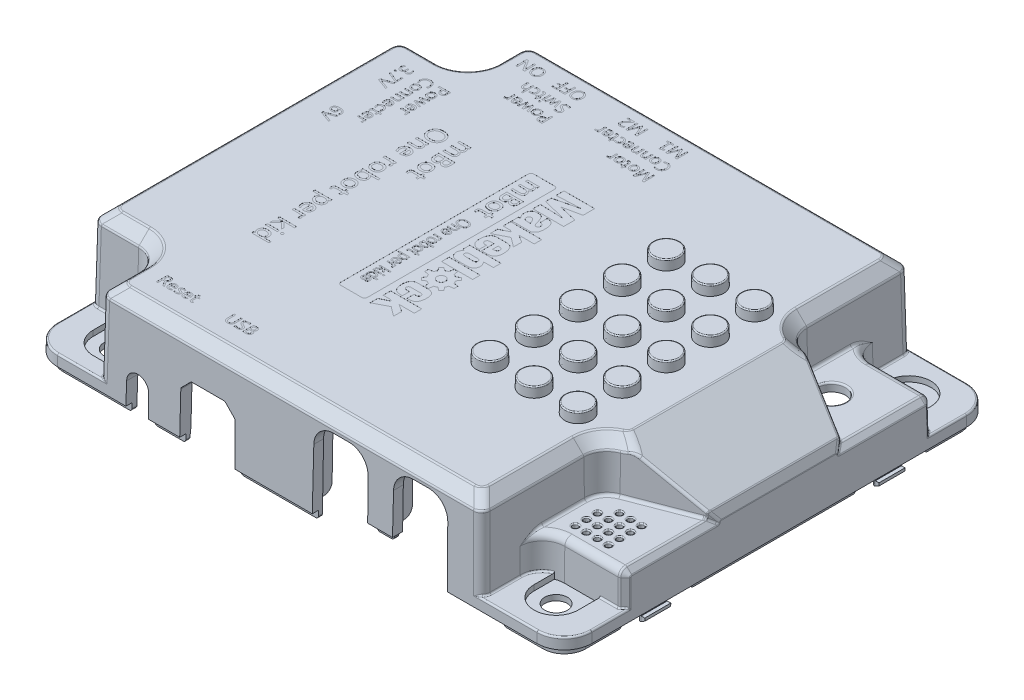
SolidWorks part; units mm, degrees
ref_plane "前视基准面" through (0, 0, 0) normal (0, 0, 1) x (1, 0, 0)
ref_plane "上视基准面" through (0, 0, 0) normal (0, 1, 0) x (1, 0, 0)
ref_plane "右视基准面" through (0, 0, 0) normal (1, 0, 0) x (0, 0, -1)
imported_body "曲面-输入2" [suppressed]
imported_body "曲面-输入3" [suppressed]
imported_body "曲面-输入4" [suppressed]
imported_body "曲面-输入5" [suppressed]
imported_body "曲面-输入6" [suppressed]
imported_body "曲面-输入7" [suppressed]
imported_body "曲面-输入8" [suppressed]
imported_body "曲面-输入9" [suppressed]
imported_body "输入1"
sketch "草图1" plane through (0, 27, 0) normal (0, 1, 0) x (1, 0, 0)
  line L0 (0, 0) -> (-42.1126, 0) construction
  line L1 (-32.3217, 25) -> (-44.3217, 25)
  line L2 (-32.3217, 36) -> (0.6783, 36)
  line L3 (-32.3217, 36) -> (-32.3217, -36) construction
  line L4 (-32.3217, -36) -> (0.6783, -36)
  line L5 (0.6783, 36) -> (0.6783, -36)
  line L6 (-32.3217, 36) -> (0.6783, -36) construction
  line L7 (-32.3217, -36) -> (0.6783, 36) construction
  line L8 (-44.3217, 25) -> (-44.3217, -25)
  line L9 (-32.3217, -25) -> (-44.3217, -25)
  line L12 (-48.2417, 26.2254) -> (-48.2417, -26.2254) construction
  line L13 (-32.3217, -25) -> (-32.3217, -36)
  line L14 (-32.3217, 36) -> (-32.3217, 25)
  point P3 (-15.8217, 0)
  point P12 (-44.3217, 0)
  dimension "D1" = 72
  dimension "D2" = 33
  dimension "D3" = 12
  dimension "D4" = 50
  dimension "D5" = 3.92
sketch "草图4" plane through (0, 27, 0) normal (0, 1, 0) x (1, 0, 0)
  line L0 (-8.1683, 17.5926) -> (-2.5917, 17.5926)
  line L1 (-2.5917, 17.5926) -> (-2.5917, 15.4914)
  line L2 (-2.5917, 15.4914) -> (-5.9326, 14.7724)
  line L3 (-5.9326, 14.7724) -> (-2.5917, 13.9973)
  line L4 (-2.5917, 13.9973) -> (-2.5917, 11.9615)
  line L5 (-2.5917, 11.9615) -> (-8.1683, 11.9615)
  line L6 (-8.1683, 11.9615) -> (-8.1683, 13.3249)
  line L7 (-8.1683, 13.3249) -> (-3.8728, 13.1942)
  line L8 (-3.8728, 13.1942) -> (-8.1683, 14.2587)
  line L9 (-8.1683, 14.2587) -> (-8.1683, 15.2953)
  line L10 (-8.1683, 15.2953) -> (-3.8728, 16.3599)
  line L11 (-3.8728, 16.3599) -> (-8.1683, 16.1638)
  line L12 (-8.1683, 16.1638) -> (-8.1683, 17.5926)
  line L13 (-5.3465, 10.4516) -> (-5.3465, 11.7496)
  line L14 (-5.0032, 8.1543) -> (-7.4147, 8.1543)
  line L15 (-8.1683, 8.0236) -> (-8.1683, 9.3216)
  line L16 (-8.1683, 9.3216) -> (-7.758, 9.387)
  line L17 (-6.77, 9.4524) -> (-6.1085, 9.4524)
  line L18 (-8.1683, 7.9118) -> (-2.5164, 7.9118)
  line L19 (-2.5164, 7.9118) -> (-2.5164, 6.5484)
  line L20 (-2.5164, 6.5484) -> (-5.2879, 6.5484)
  line L21 (-5.2879, 6.5484) -> (-3.9315, 5.6799)
  line L22 (-3.9315, 5.6799) -> (-3.9315, 4.1857)
  line L23 (-3.9315, 4.1857) -> (-5.6396, 5.4838)
  line L24 (-5.6396, 5.4838) -> (-8.1683, 4.1857)
  line L25 (-8.1683, 4.1857) -> (-8.1683, 5.5492)
  line L26 (-8.1683, 5.5492) -> (-6.5355, 6.3522)
  line L27 (-6.5355, 6.3522) -> (-6.8286, 6.5484)
  line L28 (-6.8286, 6.5484) -> (-8.1683, 6.5484)
  line L29 (-8.1683, 6.5484) -> (-8.1683, 7.9118)
  line L30 (-6.2257, 2.9396) -> (-6.8872, 2.9396)
  line L31 (-6.8286, 2.0058) -> (-6.6527, 2.0058)
  line L32 (-6.6527, 2.0058) -> (-6.6527, 0.7077)
  line L33 (-6.6527, 0.7077) -> (-6.8118, 0.7077)
  line L34 (-6.9458, 4.2377) -> (-5.1707, 4.2377)
  line L35 (-5.1204, 0.7077) -> (-6.2257, 0.7077)
  line L36 (-6.2257, 0.7077) -> (-6.2257, 2.9396)
  line L37 (-5.4637, 2.9396) -> (-5.4637, 1.9404)
  line L38 (-5.4637, 1.9404) -> (-5.3047, 1.9404)
  line L39 (-8.1683, 0.5043) -> (-2.5164, 0.5043)
  line L40 (-2.5164, 0.5043) -> (-2.5164, -0.8591)
  line L41 (-2.5164, -0.8591) -> (-4.2831, -0.8591)
  line L42 (-5.1707, -3.0256) -> (-7.1216, -3.0256)
  line L43 (-7.8166, -0.7937) -> (-8.1683, -0.7937)
  line L44 (-8.1683, -0.7937) -> (-8.1683, 0.5043)
  line L45 (-5.3465, -0.8591) -> (-6.8286, -0.8591)
  line L46 (-6.8286, -1.6622) -> (-5.3465, -1.6622)
  line L47 (-8.1683, -3.2474) -> (-2.5164, -3.2474)
  line L48 (-2.5164, -3.2474) -> (-2.5164, -4.6202)
  line L49 (-2.5164, -4.6202) -> (-8.1683, -4.6202)
  line L50 (-8.1683, -4.6202) -> (-8.1683, -3.2474)
  line L51 (-6.3463, -12.2571) -> (-6.3463, -13.5552)
  line L52 (-6.3463, -13.5552) -> (-6.5388, -13.5552)
  line L53 (-6.8738, -10.156) -> (-5.0987, -10.156)
  line L54 (-5.3498, -13.5552) -> (-5.5089, -13.5552)
  line L55 (-5.5089, -13.5552) -> (-5.5089, -12.2571)
  line L56 (-5.5089, -12.2571) -> (-5.0987, -12.2571)
  line L57 (-5.0484, -11.454) -> (-6.8738, -11.454)
  line L58 (-6.8738, -12.2571) -> (-6.3463, -12.2571)
  line L59 (-8.1683, -13.8491) -> (-2.5164, -13.8491)
  line L60 (-2.5164, -13.8491) -> (-2.5164, -15.2125)
  line L61 (-2.5164, -15.2125) -> (-5.2879, -15.2125)
  line L62 (-5.2879, -15.2125) -> (-3.9315, -16.0809)
  line L63 (-3.9315, -16.0809) -> (-3.9315, -17.5751)
  line L64 (-3.9315, -17.5751) -> (-5.6396, -16.2771)
  line L65 (-5.6396, -16.2771) -> (-8.1683, -17.5751)
  line L66 (-8.1683, -17.5751) -> (-8.1683, -16.2117)
  line L67 (-8.1683, -16.2117) -> (-6.5355, -15.4086)
  line L68 (-6.5355, -15.4086) -> (-6.8286, -15.2125)
  line L69 (-6.8286, -15.2125) -> (-8.1683, -15.2125)
  line L70 (-8.1683, -15.2125) -> (-8.1683, -13.8491)
  line L71 (-3.8532, -8.3635) -> (-3.4224, -8.9566)
  line L72 (-4.994, -9.2045) -> (-5.1271, -10.0437)
  line L73 (-6.4551, -8.9829) -> (-7.0481, -9.4136)
  line L74 (-7.5052, -8.9565) -> (-7.0745, -8.3633)
  line L75 (-7.2959, -7.842) -> (-8.1352, -7.7089)
  line L76 (-7.0742, -6.3811) -> (-7.5051, -5.7878)
  line L77 (-5.9336, -5.5402) -> (-5.8004, -4.7007)
  line L78 (-4.4726, -5.7618) -> (-3.8794, -5.3309)
  line L79 (-3.4223, -5.7879) -> (-3.8531, -6.3813)
  line L80 (-3.6316, -6.9024) -> (-2.7922, -7.0355)
  line L83 (-2.5917, 36) -> (-2.5917, -36) construction
  line L84 (-32.3217, 36) -> (0.6783, 36) construction
  line L85 (-32.3217, -36) -> (0.6783, -36) construction
  line L86 (0.6783, 36) -> (0.6783, -36) construction
  spline S0 degree 3 poles (-7.758, 9.387) (-7.9031, 9.4617) (-8.0176, 9.5846) (-8.1013, 9.7558) knots 0 0 0 0 0.027027 0.027027 0.027027 0.027027
  spline S1 degree 3 poles (-8.1013, 9.7558) (-8.185, 9.9271) (-8.2408, 10.1092) (-8.2688, 10.3022) knots 0.027027 0.027027 0.027027 0.027027 0.054054 0.054054 0.054054 0.054054
  spline S2 degree 3 poles (-8.2688, 10.3022) (-8.2688, 10.3333) (-8.2702, 10.366) (-8.273, 10.4002) knots 0.054054 0.054054 0.054054 0.054054 0.081081 0.081081 0.081081 0.081081
  spline S3 degree 3 poles (-8.273, 10.4002) (-8.2757, 10.4345) (-8.2771, 10.4672) (-8.2771, 10.4983) knots 0.081081 0.081081 0.081081 0.081081 0.108108 0.108108 0.108108 0.108108
  spline S4 degree 3 poles (-8.2771, 10.4983) (-8.2771, 10.5045) (-8.2771, 10.5123) (-8.2771, 10.5216) knots 0.108108 0.108108 0.108108 0.108108 0.135135 0.135135 0.135135 0.135135
  spline S5 degree 3 poles (-8.2771, 10.5216) (-8.2771, 10.5309) (-8.2771, 10.5418) (-8.2771, 10.5543) knots 0.135135 0.135135 0.135135 0.135135 0.162162 0.162162 0.162162 0.162162
  spline S6 degree 3 poles (-8.2771, 10.5543) (-8.266, 10.8531) (-8.1683, 11.1271) (-7.9841, 11.3761) knots 0.162162 0.162162 0.162162 0.162162 0.189189 0.189189 0.189189 0.189189
  spline S7 degree 3 poles (-7.9841, 11.3761) (-7.7998, 11.6251) (-7.5124, 11.7496) (-7.1216, 11.7496) knots 0.189189 0.189189 0.189189 0.189189 0.216216 0.216216 0.216216 0.216216
  spline S8 degree 3 poles (-7.1216, 11.7496) (-6.6471, 11.7496) (-6.329, 11.6593) (-6.1671, 11.4788) knots 0.216216 0.216216 0.216216 0.216216 0.243243 0.243243 0.243243 0.243243
  spline S9 degree 3 poles (-6.1671, 11.4788) (-6.0052, 11.2983) (-5.8768, 11.0399) (-5.7819, 10.7037) knots 0.243243 0.243243 0.243243 0.243243 0.27027 0.27027 0.27027 0.27027
  spline S10 degree 3 poles (-5.7819, 10.7037) (-5.7429, 10.5792) (-5.7038, 10.4453) (-5.6647, 10.3022) knots 0.27027 0.27027 0.27027 0.27027 0.297297 0.297297 0.297297 0.297297
  spline S11 degree 3 poles (-5.6647, 10.3022) (-5.6256, 10.159) (-5.5782, 10.0064) (-5.5224, 9.8446) knots 0.297297 0.297297 0.297297 0.297297 0.324324 0.324324 0.324324 0.324324
  spline S12 degree 3 poles (-5.5224, 9.8446) (-5.4889, 9.745) (-5.447, 9.6672) (-5.3968, 9.6111) knots 0.324324 0.324324 0.324324 0.324324 0.351351 0.351351 0.351351 0.351351
  spline S13 degree 3 poles (-5.3968, 9.6111) (-5.3465, 9.5551) (-5.2935, 9.5146) (-5.2377, 9.4897) knots 0.351351 0.351351 0.351351 0.351351 0.378378 0.378378 0.378378 0.378378
  spline S14 degree 3 poles (-5.2377, 9.4897) (-5.2153, 9.4773) (-5.193, 9.4679) (-5.1707, 9.4617) knots 0.378378 0.378378 0.378378 0.378378 0.405405 0.405405 0.405405 0.405405
  spline S15 degree 3 poles (-5.1707, 9.4617) (-5.1484, 9.4555) (-5.126, 9.4524) (-5.1037, 9.4524) knots 0.405405 0.405405 0.405405 0.405405 0.432432 0.432432 0.432432 0.432432
  spline S16 degree 3 poles (-5.1037, 9.4524) (-5.0981, 9.4524) (-5.0939, 9.4524) (-5.0911, 9.4524) knots 0.432432 0.432432 0.432432 0.432432 0.459459 0.459459 0.459459 0.459459
  spline S17 degree 3 poles (-5.0911, 9.4524) (-5.0883, 9.4524) (-5.0842, 9.4524) (-5.0786, 9.4524) knots 0.459459 0.459459 0.459459 0.459459 0.486486 0.486486 0.486486 0.486486
  spline S18 degree 3 poles (-5.0786, 9.4524) (-4.9893, 9.4586) (-4.9055, 9.499) (-4.8274, 9.5738) knots 0.486486 0.486486 0.486486 0.486486 0.513514 0.513514 0.513514 0.513514
  spline S19 degree 3 poles (-4.8274, 9.5738) (-4.7492, 9.6485) (-4.7102, 9.7388) (-4.7102, 9.8446) knots 0.513514 0.513514 0.513514 0.513514 0.540541 0.540541 0.540541 0.540541
  spline S20 degree 3 poles (-4.7102, 9.8446) (-4.7102, 10.0811) (-4.759, 10.2415) (-4.8567, 10.3255) knots 0.540541 0.540541 0.540541 0.540541 0.567568 0.567568 0.567568 0.567568
  spline S21 degree 3 poles (-4.8567, 10.3255) (-4.9544, 10.4095) (-5.1176, 10.4516) (-5.3465, 10.4516) knots 0.567568 0.567568 0.567568 0.567568 0.594595 0.594595 0.594595 0.594595
  spline S22 degree 3 poles (-5.3465, 11.7496) (-4.8162, 11.7496) (-4.438, 11.594) (-4.2119, 11.2827) knots 0.621622 0.621622 0.621622 0.621622 0.648649 0.648649 0.648649 0.648649
  spline S23 degree 3 poles (-4.2119, 11.2827) (-3.9859, 10.9714) (-3.8728, 10.5418) (-3.8728, 9.994) knots 0.648649 0.648649 0.648649 0.648649 0.675676 0.675676 0.675676 0.675676
  spline S24 degree 3 poles (-3.8728, 9.994) (-3.8728, 9.3216) (-3.9719, 8.8578) (-4.1701, 8.6026) knots 0.675676 0.675676 0.675676 0.675676 0.702703 0.702703 0.702703 0.702703
  spline S25 degree 3 poles (-4.1701, 8.6026) (-4.3682, 8.3473) (-4.5873, 8.201) (-4.8274, 8.1636) knots 0.702703 0.702703 0.702703 0.702703 0.72973 0.72973 0.72973 0.72973
  spline S26 degree 3 poles (-4.8274, 8.1636) (-4.8553, 8.1636) (-4.8846, 8.1621) (-4.9153, 8.159) knots 0.72973 0.72973 0.72973 0.72973 0.756757 0.756757 0.756757 0.756757
  spline S27 degree 3 poles (-4.9153, 8.159) (-4.946, 8.1559) (-4.9753, 8.1543) (-5.0032, 8.1543) knots 0.756757 0.756757 0.756757 0.756757 0.783784 0.783784 0.783784 0.783784
  spline S28 degree 3 poles (-7.4147, 8.1543) (-7.5766, 8.1543) (-7.691, 8.1481) (-7.758, 8.1357) knots 0.810811 0.810811 0.810811 0.810811 0.837838 0.837838 0.837838 0.837838
  spline S29 degree 3 poles (-7.758, 8.1357) (-7.825, 8.1232) (-7.8836, 8.1108) (-7.9338, 8.0983) knots 0.837838 0.837838 0.837838 0.837838 0.864865 0.864865 0.864865 0.864865
  spline S30 degree 3 poles (-7.9338, 8.0983) (-7.9673, 8.0858) (-8.0008, 8.0734) (-8.0343, 8.0609) knots 0.864865 0.864865 0.864865 0.864865 0.891892 0.891892 0.891892 0.891892
  spline S31 degree 3 poles (-8.0343, 8.0609) (-8.0678, 8.0485) (-8.1125, 8.036) (-8.1683, 8.0236) knots 0.891892 0.891892 0.891892 0.891892 0.918919 0.918919 0.918919 0.918919
  spline S32 degree 3 poles (-6.1085, 9.4524) (-6.1364, 9.5146) (-6.1629, 9.5753) (-6.188, 9.6345) knots 0 0 0 0 0.055556 0.055556 0.055556 0.055556
  spline S33 degree 3 poles (-6.188, 9.6345) (-6.2131, 9.6936) (-6.2396, 9.7512) (-6.2676, 9.8072) knots 0.055556 0.055556 0.055556 0.055556 0.111111 0.111111 0.111111 0.111111
  spline S34 degree 3 poles (-6.2676, 9.8072) (-6.3457, 9.9878) (-6.4322, 10.1419) (-6.5271, 10.2695) knots 0.111111 0.111111 0.111111 0.111111 0.166667 0.166667 0.166667 0.166667
  spline S35 degree 3 poles (-6.5271, 10.2695) (-6.622, 10.3971) (-6.756, 10.4609) (-6.929, 10.4609) knots 0.166667 0.166667 0.166667 0.166667 0.222222 0.222222 0.222222 0.222222
  spline S36 degree 3 poles (-6.929, 10.4609) (-6.9346, 10.4609) (-6.9402, 10.4609) (-6.9458, 10.4609) knots 0.222222 0.222222 0.222222 0.222222 0.277778 0.277778 0.277778 0.277778
  spline S37 degree 3 poles (-6.9458, 10.4609) (-6.9514, 10.4609) (-6.957, 10.4578) (-6.9625, 10.4516) knots 0.277778 0.277778 0.277778 0.277778 0.333333 0.333333 0.333333 0.333333
  spline S38 degree 3 poles (-6.9625, 10.4516) (-6.9681, 10.4516) (-6.9737, 10.4516) (-6.9793, 10.4516) knots 0.333333 0.333333 0.333333 0.333333 0.388889 0.388889 0.388889 0.388889
  spline S39 degree 3 poles (-6.9793, 10.4516) (-6.9849, 10.4516) (-6.9932, 10.4516) (-7.0044, 10.4516) knots 0.388889 0.388889 0.388889 0.388889 0.444444 0.444444 0.444444 0.444444
  spline S40 degree 3 poles (-7.0044, 10.4516) (-7.1105, 10.4453) (-7.1984, 10.4002) (-7.2682, 10.3161) knots 0.444444 0.444444 0.444444 0.444444 0.5 0.5 0.5 0.5
  spline S41 degree 3 poles (-7.2682, 10.3161) (-7.3379, 10.2321) (-7.3784, 10.1434) (-7.3896, 10.05) knots 0.5 0.5 0.5 0.5 0.555556 0.555556 0.555556 0.555556
  spline S42 degree 3 poles (-7.3896, 10.05) (-7.3952, 10.0376) (-7.398, 10.0251) (-7.398, 10.0127) knots 0.555556 0.555556 0.555556 0.555556 0.611111 0.611111 0.611111 0.611111
  spline S43 degree 3 poles (-7.398, 10.0127) (-7.398, 10.0002) (-7.398, 9.9878) (-7.398, 9.9753) knots 0.611111 0.611111 0.611111 0.611111 0.666667 0.666667 0.666667 0.666667
  spline S44 degree 3 poles (-7.398, 9.9753) (-7.398, 9.9629) (-7.3966, 9.9489) (-7.3938, 9.9333) knots 0.666667 0.666667 0.666667 0.666667 0.722222 0.722222 0.722222 0.722222
  spline S45 degree 3 poles (-7.3938, 9.9333) (-7.391, 9.9177) (-7.3896, 9.9037) (-7.3896, 9.8913) knots 0.722222 0.722222 0.722222 0.722222 0.777778 0.777778 0.777778 0.777778
  spline S46 degree 3 poles (-7.3896, 9.8913) (-7.3672, 9.7792) (-7.3045, 9.678) (-7.2012, 9.5878) knots 0.777778 0.777778 0.777778 0.777778 0.833333 0.833333 0.833333 0.833333
  spline S47 degree 3 poles (-7.2012, 9.5878) (-7.0979, 9.4975) (-6.9542, 9.4524) (-6.77, 9.4524) knots 0.833333 0.833333 0.833333 0.833333 0.888889 0.888889 0.888889 0.888889
  spline S48 degree 3 poles (-6.8872, 2.9396) (-7.0546, 2.9396) (-7.1872, 2.8945) (-7.2849, 2.8042) knots 0.041667 0.041667 0.041667 0.041667 0.083333 0.083333 0.083333 0.083333
  spline S49 degree 3 poles (-7.2849, 2.8042) (-7.3826, 2.714) (-7.4342, 2.6159) (-7.4398, 2.51) knots 0.083333 0.083333 0.083333 0.083333 0.125 0.125 0.125 0.125
  spline S50 degree 3 poles (-7.4398, 2.51) (-7.4398, 2.5038) (-7.4398, 2.4992) (-7.4398, 2.496) knots 0.125 0.125 0.125 0.125 0.166667 0.166667 0.166667 0.166667
  spline S51 degree 3 poles (-7.4398, 2.496) (-7.4398, 2.4929) (-7.4398, 2.4883) (-7.4398, 2.4821) knots 0.166667 0.166667 0.166667 0.166667 0.208333 0.208333 0.208333 0.208333
  spline S52 degree 3 poles (-7.4398, 2.4821) (-7.4398, 2.4758) (-7.4398, 2.4711) (-7.4398, 2.468) knots 0.208333 0.208333 0.208333 0.208333 0.25 0.25 0.25 0.25
  spline S53 degree 3 poles (-7.4398, 2.468) (-7.4398, 2.4649) (-7.4398, 2.4603) (-7.4398, 2.454) knots 0.25 0.25 0.25 0.25 0.291667 0.291667 0.291667 0.291667
  spline S54 degree 3 poles (-7.4398, 2.454) (-7.4342, 2.342) (-7.3798, 2.2393) (-7.2765, 2.1459) knots 0.291667 0.291667 0.291667 0.291667 0.333333 0.333333 0.333333 0.333333
  spline S55 degree 3 poles (-7.2765, 2.1459) (-7.1733, 2.0525) (-7.0239, 2.0058) (-6.8286, 2.0058) knots 0.333333 0.333333 0.333333 0.333333 0.375 0.375 0.375 0.375
  spline S56 degree 3 poles (-6.8118, 0.7077) (-7.264, 0.7077) (-7.6212, 0.8478) (-7.8836, 1.128) knots 0.5 0.5 0.5 0.5 0.541667 0.541667 0.541667 0.541667
  spline S57 degree 3 poles (-7.8836, 1.128) (-8.1459, 1.4081) (-8.2771, 1.8097) (-8.2771, 2.3326) knots 0.541667 0.541667 0.541667 0.541667 0.583333 0.583333 0.583333 0.583333
  spline S58 degree 3 poles (-8.2771, 2.3326) (-8.2771, 2.8992) (-8.1641, 3.3583) (-7.938, 3.71) knots 0.583333 0.583333 0.583333 0.583333 0.625 0.625 0.625 0.625
  spline S59 degree 3 poles (-7.938, 3.71) (-7.7119, 4.0618) (-7.3812, 4.2377) (-6.9458, 4.2377) knots 0.625 0.625 0.625 0.625 0.666667 0.666667 0.666667 0.666667
  spline S60 degree 3 poles (-5.1707, 4.2377) (-4.6683, 4.2377) (-4.3166, 4.0447) (-4.1156, 3.6587) knots 0.708333 0.708333 0.708333 0.708333 0.75 0.75 0.75 0.75
  spline S61 degree 3 poles (-4.1156, 3.6587) (-3.9147, 3.2727) (-3.8142, 2.8307) (-3.8142, 2.3326) knots 0.75 0.75 0.75 0.75 0.791667 0.791667 0.791667 0.791667
  spline S62 degree 3 poles (-3.8142, 2.3326) (-3.8142, 1.8097) (-3.9273, 1.4081) (-4.1533, 1.128) knots 0.791667 0.791667 0.791667 0.791667 0.833333 0.833333 0.833333 0.833333
  spline S63 degree 3 poles (-4.1533, 1.128) (-4.3794, 0.8478) (-4.7018, 0.7077) (-5.1204, 0.7077) knots 0.833333 0.833333 0.833333 0.833333 0.875 0.875 0.875 0.875
  spline S64 degree 3 poles (-5.3047, 1.9404) (-5.126, 1.9404) (-4.9725, 1.9871) (-4.8441, 2.0805) knots 0.222222 0.222222 0.222222 0.222222 0.333333 0.333333 0.333333 0.333333
  spline S65 degree 3 poles (-4.8441, 2.0805) (-4.7157, 2.1739) (-4.6515, 2.3077) (-4.6515, 2.4821) knots 0.333333 0.333333 0.333333 0.333333 0.444444 0.444444 0.444444 0.444444
  spline S66 degree 3 poles (-4.6515, 2.4821) (-4.6515, 2.675) (-4.7339, 2.7996) (-4.8985, 2.8556) knots 0.444444 0.444444 0.444444 0.444444 0.555556 0.555556 0.555556 0.555556
  spline S67 degree 3 poles (-4.8985, 2.8556) (-5.0632, 2.9116) (-5.2432, 2.9396) (-5.4386, 2.9396) knots 0.555556 0.555556 0.555556 0.555556 0.666667 0.666667 0.666667 0.666667
  spline S68 degree 3 poles (-5.4386, 2.9396) (-5.4442, 2.9396) (-5.4484, 2.9396) (-5.4512, 2.9396) knots 0.666667 0.666667 0.666667 0.666667 0.777778 0.777778 0.777778 0.777778
  spline S69 degree 3 poles (-5.4512, 2.9396) (-5.454, 2.9396) (-5.4581, 2.9396) (-5.4637, 2.9396) knots 0.777778 0.777778 0.777778 0.777778 1 1 1 1
  spline S70 degree 3 poles (-4.2831, -0.8591) (-4.2329, -0.9214) (-4.1868, -0.9868) (-4.145, -1.0552) knots 0.157895 0.157895 0.157895 0.157895 0.210526 0.210526 0.210526 0.210526
  spline S71 degree 3 poles (-4.145, -1.0552) (-4.1031, -1.1237) (-4.0654, -1.1891) (-4.0319, -1.2513) knots 0.210526 0.210526 0.210526 0.210526 0.263158 0.263158 0.263158 0.263158
  spline S72 degree 3 poles (-4.0319, -1.2513) (-3.9761, -1.3634) (-3.9356, -1.4755) (-3.9105, -1.5875) knots 0.263158 0.263158 0.263158 0.263158 0.315789 0.315789 0.315789 0.315789
  spline S73 degree 3 poles (-3.9105, -1.5875) (-3.8854, -1.6996) (-3.8728, -1.8054) (-3.8728, -1.905) knots 0.315789 0.315789 0.315789 0.315789 0.368421 0.368421 0.368421 0.368421
  spline S74 degree 3 poles (-3.8728, -1.905) (-3.8728, -2.2163) (-3.9859, -2.4809) (-4.2119, -2.6988) knots 0.368421 0.368421 0.368421 0.368421 0.421053 0.421053 0.421053 0.421053
  spline S75 degree 3 poles (-4.2119, -2.6988) (-4.438, -2.9167) (-4.7576, -3.0256) (-5.1707, -3.0256) knots 0.421053 0.421053 0.421053 0.421053 0.473684 0.473684 0.473684 0.473684
  spline S76 degree 3 poles (-7.1216, -3.0256) (-7.4398, -3.0256) (-7.7175, -2.9043) (-7.9548, -2.6614) knots 0.526316 0.526316 0.526316 0.526316 0.578947 0.578947 0.578947 0.578947
  spline S77 degree 3 poles (-7.9548, -2.6614) (-8.192, -2.4186) (-8.3106, -2.1323) (-8.3106, -1.8023) knots 0.578947 0.578947 0.578947 0.578947 0.631579 0.631579 0.631579 0.631579
  spline S78 degree 3 poles (-8.3106, -1.8023) (-8.3106, -1.7276) (-8.3022, -1.6498) (-8.2855, -1.5689) knots 0.631579 0.631579 0.631579 0.631579 0.684211 0.684211 0.684211 0.684211
  spline S79 degree 3 poles (-8.2855, -1.5689) (-8.2688, -1.4879) (-8.2436, -1.407) (-8.2101, -1.326) knots 0.684211 0.684211 0.684211 0.684211 0.736842 0.736842 0.736842 0.736842
  spline S80 degree 3 poles (-8.2101, -1.326) (-8.1711, -1.2327) (-8.1194, -1.1408) (-8.0552, -1.0506) knots 0.736842 0.736842 0.736842 0.736842 0.789474 0.789474 0.789474 0.789474
  spline S81 degree 3 poles (-8.0552, -1.0506) (-7.9911, -0.9603) (-7.9115, -0.8747) (-7.8166, -0.7937) knots 0.789474 0.789474 0.789474 0.789474 0.842105 0.842105 0.842105 0.842105
  spline S82 degree 3 poles (-6.8286, -0.8591) (-6.9681, -0.8591) (-7.084, -0.8949) (-7.1761, -0.9665) knots 0.052632 0.052632 0.052632 0.052632 0.105263 0.105263 0.105263 0.105263
  spline S83 degree 3 poles (-7.1761, -0.9665) (-7.2682, -1.0381) (-7.3282, -1.1175) (-7.3561, -1.2046) knots 0.105263 0.105263 0.105263 0.105263 0.157895 0.157895 0.157895 0.157895
  spline S84 degree 3 poles (-7.3561, -1.2046) (-7.3561, -1.2171) (-7.3575, -1.2311) (-7.3603, -1.2467) knots 0.157895 0.157895 0.157895 0.157895 0.210526 0.210526 0.210526 0.210526
  spline S85 degree 3 poles (-7.3603, -1.2467) (-7.363, -1.2622) (-7.3644, -1.2762) (-7.3644, -1.2887) knots 0.210526 0.210526 0.210526 0.210526 0.263158 0.263158 0.263158 0.263158
  spline S86 degree 3 poles (-7.3644, -1.2887) (-7.3644, -1.2949) (-7.3644, -1.3027) (-7.3644, -1.312) knots 0.263158 0.263158 0.263158 0.263158 0.315789 0.315789 0.315789 0.315789
  spline S87 degree 3 poles (-7.3644, -1.312) (-7.3644, -1.3214) (-7.3644, -1.3291) (-7.3644, -1.3354) knots 0.315789 0.315789 0.315789 0.315789 0.368421 0.368421 0.368421 0.368421
  spline S88 degree 3 poles (-7.3644, -1.3354) (-7.3477, -1.4163) (-7.2947, -1.491) (-7.2054, -1.5595) knots 0.368421 0.368421 0.368421 0.368421 0.421053 0.421053 0.421053 0.421053
  spline S89 degree 3 poles (-7.2054, -1.5595) (-7.116, -1.628) (-6.9904, -1.6622) (-6.8286, -1.6622) knots 0.421053 0.421053 0.421053 0.421053 0.473684 0.473684 0.473684 0.473684
  spline S90 degree 3 poles (-5.3465, -1.6622) (-5.2181, -1.6622) (-5.1176, -1.6295) (-5.0451, -1.5642) knots 0.526316 0.526316 0.526316 0.526316 0.578947 0.578947 0.578947 0.578947
  spline S91 degree 3 poles (-5.0451, -1.5642) (-4.9725, -1.4988) (-4.9251, -1.4288) (-4.9027, -1.3541) knots 0.578947 0.578947 0.578947 0.578947 0.631579 0.631579 0.631579 0.631579
  spline S92 degree 3 poles (-4.9027, -1.3541) (-4.9027, -1.3354) (-4.9013, -1.3198) (-4.8985, -1.3074) knots 0.631579 0.631579 0.631579 0.631579 0.684211 0.684211 0.684211 0.684211
  spline S93 degree 3 poles (-4.8985, -1.3074) (-4.8958, -1.2949) (-4.8943, -1.2825) (-4.8943, -1.27) knots 0.684211 0.684211 0.684211 0.684211 0.736842 0.736842 0.736842 0.736842
  spline S94 degree 3 poles (-4.8943, -1.27) (-4.8943, -1.2638) (-4.8943, -1.256) (-4.8943, -1.2467) knots 0.736842 0.736842 0.736842 0.736842 0.789474 0.789474 0.789474 0.789474
  spline S95 degree 3 poles (-4.8943, -1.2467) (-4.8943, -1.2373) (-4.8943, -1.2295) (-4.8943, -1.2233) knots 0.789474 0.789474 0.789474 0.789474 0.842105 0.842105 0.842105 0.842105
  spline S96 degree 3 poles (-4.8943, -1.2233) (-4.9111, -1.1299) (-4.9586, -1.0459) (-5.0367, -0.9712) knots 0.842105 0.842105 0.842105 0.842105 0.894737 0.894737 0.894737 0.894737
  spline S97 degree 3 poles (-5.0367, -0.9712) (-5.1148, -0.8965) (-5.2181, -0.8591) (-5.3465, -0.8591) knots 0.894737 0.894737 0.894737 0.894737 1 1 1 1
  spline S98 degree 3 poles (-6.5388, -13.5552) (-7.164, -13.5552) (-7.598, -13.4011) (-7.8409, -13.0929) knots 0.060606 0.060606 0.060606 0.060606 0.090909 0.090909 0.090909 0.090909
  spline S99 degree 3 poles (-7.8409, -13.0929) (-8.0837, -12.7847) (-8.2051, -12.3474) (-8.2051, -11.7808) knots 0.090909 0.090909 0.090909 0.090909 0.121212 0.121212 0.121212 0.121212
  spline S100 degree 3 poles (-8.2051, -11.7808) (-8.2051, -11.289) (-8.099, -10.8952) (-7.8869, -10.5995) knots 0.121212 0.121212 0.121212 0.121212 0.151515 0.151515 0.151515 0.151515
  spline S101 degree 3 poles (-7.8869, -10.5995) (-7.6748, -10.3038) (-7.3371, -10.156) (-6.8738, -10.156) knots 0.151515 0.151515 0.151515 0.151515 0.181818 0.181818 0.181818 0.181818
  spline S102 degree 3 poles (-5.0987, -10.156) (-4.7135, -10.156) (-4.3911, -10.2618) (-4.1315, -10.4735) knots 0.212121 0.212121 0.212121 0.212121 0.242424 0.242424 0.242424 0.242424
  spline S103 degree 3 poles (-4.1315, -10.4735) (-3.872, -10.6851) (-3.7422, -11.0992) (-3.7422, -11.7155) knots 0.242424 0.242424 0.242424 0.242424 0.272727 0.272727 0.272727 0.272727
  spline S104 degree 3 poles (-3.7422, -11.7155) (-3.7422, -12.282) (-3.851, -12.7302) (-4.0687, -13.0602) knots 0.272727 0.272727 0.272727 0.272727 0.30303 0.30303 0.30303 0.30303
  spline S105 degree 3 poles (-4.0687, -13.0602) (-4.2864, -13.3902) (-4.7135, -13.5552) (-5.3498, -13.5552) knots 0.30303 0.30303 0.30303 0.30303 0.333333 0.333333 0.333333 0.333333
  spline S106 degree 3 poles (-5.0987, -12.2571) (-4.9703, -12.2571) (-4.8712, -12.2244) (-4.8014, -12.159) knots 0.424242 0.424242 0.424242 0.424242 0.454545 0.454545 0.454545 0.454545
  spline S107 degree 3 poles (-4.8014, -12.159) (-4.7316, -12.0937) (-4.6884, -12.0236) (-4.6716, -11.9489) knots 0.454545 0.454545 0.454545 0.454545 0.484848 0.484848 0.484848 0.484848
  spline S108 degree 3 poles (-4.6716, -11.9489) (-4.6716, -11.9303) (-4.6702, -11.9147) (-4.6674, -11.9022) knots 0.484848 0.484848 0.484848 0.484848 0.515152 0.515152 0.515152 0.515152
  spline S109 degree 3 poles (-4.6674, -11.9022) (-4.6646, -11.8898) (-4.6632, -11.8773) (-4.6632, -11.8649) knots 0.515152 0.515152 0.515152 0.515152 0.545455 0.545455 0.545455 0.545455
  spline S110 degree 3 poles (-4.6632, -11.8649) (-4.6632, -11.8587) (-4.6632, -11.8509) (-4.6632, -11.8415) knots 0.545455 0.545455 0.545455 0.545455 0.575758 0.575758 0.575758 0.575758
  spline S111 degree 3 poles (-4.6632, -11.8415) (-4.6632, -11.8322) (-4.6632, -11.8244) (-4.6632, -11.8182) knots 0.575758 0.575758 0.575758 0.575758 0.606061 0.606061 0.606061 0.606061
  spline S112 degree 3 poles (-4.6632, -11.8182) (-4.6744, -11.7248) (-4.7149, -11.6408) (-4.7847, -11.5661) knots 0.606061 0.606061 0.606061 0.606061 0.636364 0.636364 0.636364 0.636364
  spline S113 degree 3 poles (-4.7847, -11.5661) (-4.8544, -11.4914) (-4.9424, -11.454) (-5.0484, -11.454) knots 0.636364 0.636364 0.636364 0.636364 0.666667 0.666667 0.666667 0.666667
  spline S114 degree 3 poles (-6.8738, -11.454) (-7.0077, -11.454) (-7.1152, -11.4914) (-7.1961, -11.5661) knots 0.69697 0.69697 0.69697 0.69697 0.727273 0.727273 0.727273 0.727273
  spline S115 degree 3 poles (-7.1961, -11.5661) (-7.2771, -11.6408) (-7.3259, -11.7248) (-7.3427, -11.8182) knots 0.727273 0.727273 0.727273 0.727273 0.757576 0.757576 0.757576 0.757576
  spline S116 degree 3 poles (-7.3427, -11.8182) (-7.3427, -11.8244) (-7.3427, -11.8322) (-7.3427, -11.8415) knots 0.757576 0.757576 0.757576 0.757576 0.787879 0.787879 0.787879 0.787879
  spline S117 degree 3 poles (-7.3427, -11.8415) (-7.3427, -11.8509) (-7.3427, -11.8587) (-7.3427, -11.8649) knots 0.787879 0.787879 0.787879 0.787879 0.818182 0.818182 0.818182 0.818182
  spline S118 degree 3 poles (-7.3427, -11.8649) (-7.3427, -11.8773) (-7.3413, -11.8898) (-7.3385, -11.9022) knots 0.818182 0.818182 0.818182 0.818182 0.848485 0.848485 0.848485 0.848485
  spline S119 degree 3 poles (-7.3385, -11.9022) (-7.3357, -11.9147) (-7.3343, -11.9303) (-7.3343, -11.9489) knots 0.848485 0.848485 0.848485 0.848485 0.878788 0.878788 0.878788 0.878788
  spline S120 degree 3 poles (-7.3343, -11.9489) (-7.312, -12.0236) (-7.2617, -12.0937) (-7.1836, -12.159) knots 0.878788 0.878788 0.878788 0.878788 0.909091 0.909091 0.909091 0.909091
  spline S121 degree 3 poles (-7.1836, -12.159) (-7.1054, -12.2244) (-7.0022, -12.2571) (-6.8738, -12.2571) knots 0.909091 0.909091 0.909091 0.909091 0.939394 0.939394 0.939394 0.939394
  spline S122 degree 3 poles (-3.6316, -7.8423) (-3.6793, -8.0287) (-3.7547, -8.204) (-3.8532, -8.3635) knots 0 0 0 0 0.02439 0.02439 0.02439 0.02439
  spline S123 degree 3 poles (-3.4224, -8.9566) (-3.4985, -9.0327) (-3.5747, -9.1089) (-3.6509, -9.1851) knots 0.04878 0.04878 0.04878 0.04878 0.073171 0.073171 0.073171 0.073171
  spline S124 degree 3 poles (-3.6509, -9.1851) (-3.727, -9.2612) (-3.8033, -9.3375) (-3.8794, -9.4137) knots 0.073171 0.073171 0.073171 0.073171 0.097561 0.097561 0.097561 0.097561
  spline S125 degree 3 poles (-3.8794, -9.4137) (-4.0771, -9.2701) (-4.2749, -9.1265) (-4.4726, -8.983) knots 0.097561 0.097561 0.097561 0.097561 0.121951 0.121951 0.121951 0.121951
  spline S126 degree 3 poles (-4.4726, -8.983) (-4.6323, -9.0814) (-4.8076, -9.1568) (-4.994, -9.2045) knots 0.121951 0.121951 0.121951 0.121951 0.146341 0.146341 0.146341 0.146341
  spline S127 degree 3 poles (-5.1271, -10.0437) (-5.2392, -10.0438) (-5.3515, -10.0437) (-5.4637, -10.0438) knots 0.170732 0.170732 0.170732 0.170732 0.195122 0.195122 0.195122 0.195122
  spline S128 degree 3 poles (-5.4637, -10.0438) (-5.5759, -10.0438) (-5.6883, -10.0438) (-5.8006, -10.0438) knots 0.195122 0.195122 0.195122 0.195122 0.219512 0.219512 0.219512 0.219512
  spline S129 degree 3 poles (-5.8006, -10.0438) (-5.8449, -9.764) (-5.8894, -9.4842) (-5.9338, -9.2045) knots 0.219512 0.219512 0.219512 0.219512 0.243902 0.243902 0.243902 0.243902
  spline S130 degree 3 poles (-5.9338, -9.2045) (-6.1202, -9.1568) (-6.2955, -9.0813) (-6.4551, -8.9829) knots 0.243902 0.243902 0.243902 0.243902 0.268293 0.268293 0.268293 0.268293
  spline S131 degree 3 poles (-7.0481, -9.4136) (-7.1242, -9.3375) (-7.2004, -9.2613) (-7.2766, -9.1851) knots 0.292683 0.292683 0.292683 0.292683 0.317073 0.317073 0.317073 0.317073
  spline S132 degree 3 poles (-7.2766, -9.1851) (-7.3527, -9.109) (-7.429, -9.0327) (-7.5052, -8.9565) knots 0.317073 0.317073 0.317073 0.317073 0.341463 0.341463 0.341463 0.341463
  spline S133 degree 3 poles (-7.0745, -8.3633) (-7.1729, -8.2037) (-7.2483, -8.0284) (-7.2959, -7.842) knots 0.365854 0.365854 0.365854 0.365854 0.390244 0.390244 0.390244 0.390244
  spline S134 degree 3 poles (-8.1352, -7.7089) (-8.1353, -7.5968) (-8.1352, -7.4845) (-8.1353, -7.3722) knots 0.414634 0.414634 0.414634 0.414634 0.439024 0.439024 0.439024 0.439024
  spline S135 degree 3 poles (-8.1353, -7.3722) (-8.1353, -7.2601) (-8.1353, -7.1477) (-8.1353, -7.0354) knots 0.439024 0.439024 0.439024 0.439024 0.463415 0.463415 0.463415 0.463415
  spline S136 degree 3 poles (-8.1353, -7.0354) (-7.8555, -6.9911) (-7.5756, -6.9466) (-7.2958, -6.9022) knots 0.463415 0.463415 0.463415 0.463415 0.487805 0.487805 0.487805 0.487805
  spline S137 degree 3 poles (-7.2958, -6.9022) (-7.2481, -6.7158) (-7.1727, -6.5406) (-7.0742, -6.3811) knots 0.487805 0.487805 0.487805 0.487805 0.512195 0.512195 0.512195 0.512195
  spline S138 degree 3 poles (-7.5051, -5.7878) (-7.429, -5.7117) (-7.3528, -5.6356) (-7.2766, -5.5594) knots 0.536585 0.536585 0.536585 0.536585 0.560976 0.560976 0.560976 0.560976
  spline S139 degree 3 poles (-7.2766, -5.5594) (-7.2005, -5.4833) (-7.1242, -5.407) (-7.0481, -5.3308) knots 0.560976 0.560976 0.560976 0.560976 0.585366 0.585366 0.585366 0.585366
  spline S140 degree 3 poles (-7.0481, -5.3308) (-6.8503, -5.4744) (-6.6525, -5.618) (-6.4547, -5.7616) knots 0.585366 0.585366 0.585366 0.585366 0.609756 0.609756 0.609756 0.609756
  spline S141 degree 3 poles (-6.4547, -5.7616) (-6.2951, -5.6632) (-6.1199, -5.5879) (-5.9336, -5.5402) knots 0.609756 0.609756 0.609756 0.609756 0.634146 0.634146 0.634146 0.634146
  spline S142 degree 3 poles (-5.8004, -4.7007) (-5.6883, -4.7007) (-5.576, -4.7007) (-5.4637, -4.7007) knots 0.658537 0.658537 0.658537 0.658537 0.682927 0.682927 0.682927 0.682927
  spline S143 degree 3 poles (-5.4637, -4.7007) (-5.3516, -4.7007) (-5.2392, -4.7007) (-5.1269, -4.7007) knots 0.682927 0.682927 0.682927 0.682927 0.707317 0.707317 0.707317 0.707317
  spline S144 degree 3 poles (-5.1269, -4.7007) (-5.0826, -4.9805) (-5.0381, -5.2605) (-4.9936, -5.5403) knots 0.707317 0.707317 0.707317 0.707317 0.731707 0.731707 0.731707 0.731707
  spline S145 degree 3 poles (-4.9936, -5.5403) (-4.8074, -5.588) (-4.6321, -5.6634) (-4.4726, -5.7618) knots 0.731707 0.731707 0.731707 0.731707 0.756098 0.756098 0.756098 0.756098
  spline S146 degree 3 poles (-3.8794, -5.3309) (-3.8033, -5.407) (-3.7271, -5.4831) (-3.6509, -5.5594) knots 0.780488 0.780488 0.780488 0.780488 0.804878 0.804878 0.804878 0.804878
  spline S147 degree 3 poles (-3.6509, -5.5594) (-3.5748, -5.6354) (-3.4985, -5.7117) (-3.4223, -5.7879) knots 0.804878 0.804878 0.804878 0.804878 0.829268 0.829268 0.829268 0.829268
  spline S148 degree 3 poles (-3.8531, -6.3813) (-3.7547, -6.5409) (-3.6793, -6.7161) (-3.6316, -6.9024) knots 0.853659 0.853659 0.853659 0.853659 0.878049 0.878049 0.878049 0.878049
  spline S149 degree 3 poles (-2.7922, -7.0355) (-2.7922, -7.1477) (-2.7922, -7.2599) (-2.7922, -7.3722) knots 0.902439 0.902439 0.902439 0.902439 0.926829 0.926829 0.926829 0.926829
  spline S150 degree 3 poles (-2.7922, -7.3722) (-2.7922, -7.4843) (-2.7922, -7.5968) (-2.7922, -7.7091) knots 0.926829 0.926829 0.926829 0.926829 0.95122 0.95122 0.95122 0.95122
  spline S151 degree 3 poles (-2.7922, -7.7091) (-3.072, -7.7534) (-3.3519, -7.7979) (-3.6316, -7.8423) knots 0.95122 0.95122 0.95122 0.95122 1 1 1 1
  spline S152 degree 3 poles (-4.7031, -7.3724) (-4.7031, -7.7924) (-5.0437, -8.133) (-5.4637, -8.133) knots 0 0 0 0 0.2 0.2 0.2 0.2
  spline S153 degree 3 poles (-5.4637, -8.133) (-5.8838, -8.133) (-6.2244, -7.7924) (-6.2244, -7.3724) knots 0.2 0.2 0.2 0.2 0.4 0.4 0.4 0.4
  spline S154 degree 3 poles (-6.2244, -7.3724) (-6.2244, -6.9523) (-5.8838, -6.6117) (-5.4637, -6.6117) knots 0.4 0.4 0.4 0.4 0.6 0.6 0.6 0.6
  spline S155 degree 3 poles (-5.4637, -6.6117) (-5.0437, -6.6117) (-4.7031, -6.9523) (-4.7031, -7.3724) knots 0.6 0.6 0.6 0.6 1 1 1 1
  dimension "D1" = 3.27
sketch "草图6" plane through (0, 27, 0) normal (0, 1, 0) x (1, 0, 0)
  line L0 (-2.0384, 28.194) -> (-16.3854, 28.194) construction
  line L1 (-2.0384, 31.3544) -> (-16.3854, 31.3544) construction
  line L2 (-2.6517, 34.85) -> (-13.4899, 34.85) construction
  line L3 (-20.5005, 31.3544) -> (-32.083, 31.3544) construction
  line L4 (-20.8671, 34.85) -> (-31.3677, 34.85) construction
  line L5 (-20.5005, 28.194) -> (-29.1501, 28.194) construction
  line L6 (-42.4579, 22.9884) -> (-42.4579, 4.0925) construction
  line L7 (-35.8843, 22.9884) -> (-35.8843, 4.0925) construction
  line L8 (-18.9605, -33.6794) -> (-9.8718, -33.6794) construction
  line L9 (-31.1217, -33.6794) -> (-24.1123, -33.6794) construction
  line L10 (-38.6175, 22.9884) -> (-38.6175, 4.0925) construction
  line L11 (-32.3217, 36) -> (0.6783, 36) construction
  line L12 (0.6783, 36) -> (0.6783, -36) construction
  text T0 "Motor    " font "微软雅黑" height 1.95
  text T1 "Connecter" font "微软雅黑" height 2
  text T2 "M1    M2" font "微软雅黑" height 2
  text T3 "Power  " font "微软雅黑" height 2
  text T4 "Switch" font "微软雅黑" height 2
  text T5 "OFF   ON  " font "微软雅黑" height 2
  text T6 "Power  " font "微软雅黑" height 2
  text T7 "Connecter" font "微软雅黑" height 2
  text T8 "3.7V         6V  " font "微软雅黑" height 2
  text T9 "Reset  " font "微软雅黑" height 2
  text T10 "USB  " font "微软雅黑" height 2
  point P22 (-2.6517, 34.85)
  dimension "D1" = 1.15
  dimension "D2" = 3.33
extrude "切除-拉伸1" cut sketch "草图6" against normal blind 0.01
extrude "切除-拉伸2" cut sketch "草图4" against normal blind 0.01
sketch "草图7" plane through (0, 27, 0) normal (0, 1, 0) x (1, 0, 0)
  line L0 (31.7254, 38.7417) -> (-34.2254, 38.7417) construction
  line L1 (-48.2417, 26.2254) -> (-48.2417, -26.2254) construction
  line L2 (-25.4417, 16.2417) -> (-25.4417, 4.7633) construction
  line L3 (-29.9017, 16.2417) -> (-29.9017, -24.4952) construction
  text T0 "mBot" font "微软雅黑" height 3
  text T1 "One robot per kid" font "微软雅黑" height 3
  point P0 (-25.4417, 16.2417)
  dimension "D1" = 22.5
  dimension "D2" = 22.8
  dimension "D3" = 4.46
extrude "切除-拉伸3" cut sketch "草图7" against normal blind 0.01
sketch "草图8" plane through (0, 27, 0) normal (0, 1, 0) x (1, 0, 0)
  line L1 (-9.7583, 17.5) -> (-13.5583, 17.5)
  line L2 (-9.2583, 17) -> (-9.2583, -17)
  line L3 (-9.7583, -17.5) -> (-13.5583, -17.5)
  line L4 (-14.0583, 17) -> (-14.0583, -17)
  line L5 (0, 0) -> (4.5095, 0) construction
  line L6 (-8.1683, 17.5926) -> (-8.1683, 16.1638) construction
  arc A0 (-9.2583, -17) -> (-9.7583, -17.5) centre (-9.7583, -17) cw
  arc A1 (-13.5583, -17.5) -> (-14.0583, -17) centre (-13.5583, -17) cw
  arc A2 (-13.5583, 17.5) -> (-14.0583, 17) centre (-13.5583, 17) ccw
  arc A3 (-9.7583, 17.5) -> (-9.2583, 17) centre (-9.7583, 17) cw
  point P11 (-9.2583, -17.5)
  point P16 (-14.0583, 17.5)
  point P19 (-9.2583, 17.5)
  dimension "D4" = 0.5
  dimension "D1" = 4.8
  dimension "D2" = 35
  dimension "D3" = 1.09
extrude "切除-拉伸4" cut sketch "草图8" against normal blind 0.01
sketch "草图9" plane through (0, 26.99, 0) normal (0, 1, 0) x (1, 0, 0)
  line L0 (-13.1583, 16.33) -> (-13.1583, 5.3956) construction
  line L1 (-9.7583, 17.5) -> (-13.5583, 17.5) construction
  line L2 (-14.0583, 17) -> (-14.0583, -17) construction
  line L3 (-13.1583, 4.24) -> (-13.1583, -16.0993) construction
  text T0 "mBot" font "微软雅黑" height 3
  text T1 "One robot per kids  " font "Arial Narrow" height 2
  dimension "D1" = 1.17
  dimension "D2" = 0.9
  dimension "D3" = 13.26
extrude "凸台-拉伸1" add sketch "草图9" along normal blind 0.01
